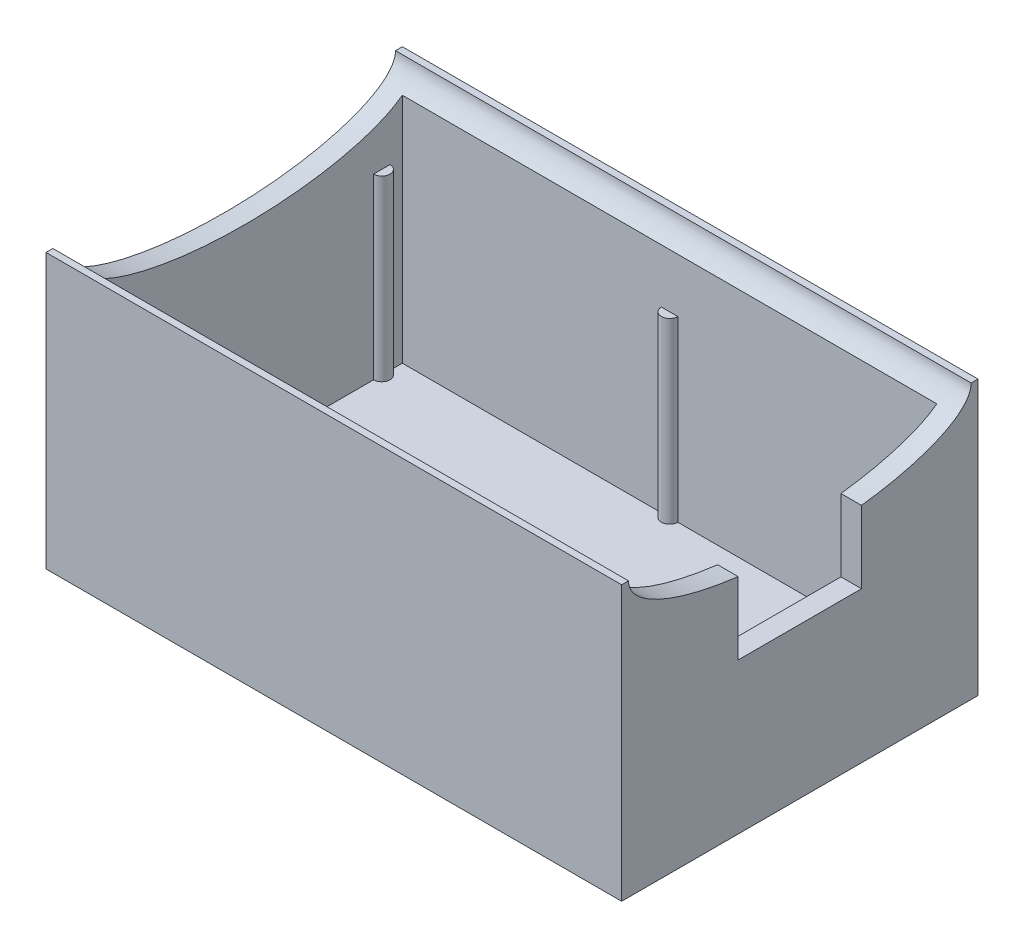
SolidWorks part; units mm, degrees
ref_plane "Front Plane" through (0, 0, 0) normal (0, 0, 1) x (1, 0, 0)
ref_plane "Top Plane" through (0, 0, 0) normal (0, 1, 0) x (1, 0, 0)
ref_plane "Right Plane" through (0, 0, 0) normal (1, 0, 0) x (0, 0, -1)
sketch "Sketch1" plane through (0, 0, 0) normal (0, 1, 0) x (1, 0, 0)
  line L1 (0, 0) -> (-42, 0)
  line L2 (0, 0) -> (0, 26)
  line L3 (0, 26) -> (-42, 26)
  line L4 (-42, 0) -> (-42, 26)
  dimension "D1" = 42
  dimension "D2" = 26
extrude "Boss-Extrude1" add sketch "Sketch1" along normal blind 20
shell "Shell1" thickness 1.5
sketch "Sketch2" plane through (-42, 0, 0) normal (-1, 0, 0) x (0, 0, 1)
  line L0 (-26, 20) -> (0, 20) construction
  ellipse E0 centre (-13, 20) end of major axis (-0.5, 20) minor radius 4
  dimension "D1" = 8
  dimension "D2" = 25
extrude "Cut-Extrude1" cut sketch "Sketch2" against normal through all
sketch "Sketch3" plane through (0, 1.5, 0) normal (0, 1, 0) x (1, 0, 0)
  line L0 (-40.5, 24.5) -> (-40.5, 1.5) construction
  line L1 (-1.5, 1.5) -> (-40.5, 1.5) construction
  line L2 (-40.5, 24.5) -> (-1.5, 24.5) construction
  line L3 (-1.5, 1.5) -> (-1.5, 24.5) construction
  circle A0 centre (-40.5, 23) radius 0.6
  circle A1 centre (-40.5, 3) radius 0.6
  circle A2 centre (-21, 1.5) radius 0.6
  circle A3 centre (-21, 24.5) radius 0.6
  circle A4 centre (-1.5, 23) radius 0.6
  circle A5 centre (-1.5, 3) radius 0.6
  dimension "D1" = 1.2
  dimension "D2" = 1.2
  dimension "D3" = 1.2
  dimension "D4" = 1.2
  dimension "D5" = 1.2
  dimension "D6" = 1.2
  dimension "D7" = 1.5
  dimension "D8" = 1.5
  dimension "D9" = 1.5
  dimension "D10" = 1.5
extrude "Boss-Extrude2" add sketch "Sketch3" along normal blind 13
sketch "Sketch4" plane through (0, 0, 0) normal (1, 0, 0) x (0, 0, -1)
  line L0 (0, 0) -> (26, 0) construction
  line L1 (8.5, 20.8939) -> (17.5, 20.8939)
  line L2 (8.5, 20.8939) -> (8.5, 11)
  line L3 (8.5, 11) -> (17.5, 11)
  line L4 (17.5, 20.8939) -> (17.5, 11)
  line L5 (0, 20) -> (0, 0) construction
  line L6 (26, 20) -> (26, 0) construction
  dimension "D1" = 11
  dimension "D2" = 8.5
  dimension "D3" = 8.5
extrude "Cut-Extrude2" cut sketch "Sketch4" against normal blind 13
sketch "Sketch5" plane through (0, 1.5, 0) normal (0, 1, 0) x (1, 0, 0)
  line L1 (-40.5, 24.5) -> (-1.5, 24.5)
  line L2 (-40.5, 24.5) -> (-40.5, 1.5)
  line L3 (-40.5, 1.5) -> (-1.5, 1.5)
  line L4 (-1.5, 24.5) -> (-1.5, 1.5)
  dimension "D1" = 39
  dimension "D2" = 23
